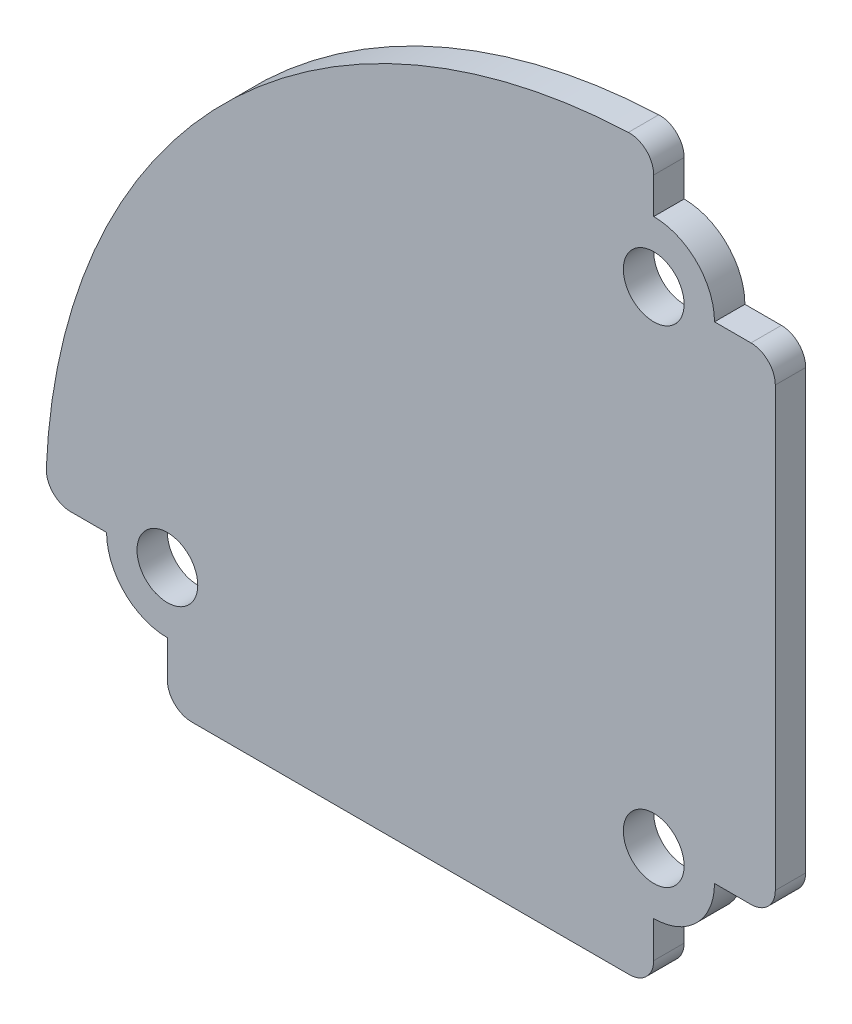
SolidWorks part; units mm, degrees
ref_plane "Front Plane" through (0, 0, 0) normal (0, 0, 1) x (1, 0, 0)
ref_plane "Top Plane" through (0, 0, 0) normal (0, 1, 0) x (1, 0, 0)
ref_plane "Right Plane" through (0, 0, 0) normal (1, 0, 0) x (0, 0, -1)
sketch "Sketch1" plane through (0, 0, 0) normal (0, 0, 1) x (1, 0, 0)
  line L0 (10.16, 50.8) -> (6.35, 50.8)
  line L2 (-60.9071, 0) -> (-57.15, 0)
  line L3 (-50.8, -6.35) -> (-50.8, -10.16)
  line L5 (-48.26, -12.7) -> (-2.54, -12.7)
  line L7 (0, -10.16) -> (0, -6.35)
  line L8 (6.35, 0) -> (10.16, 0)
  line L9 (12.7, 2.54) -> (12.7, 48.26)
  line L10 (0, 57.15) -> (0, 60.9071)
  arc A0 (-50.8, -10.16) -> (-48.26, -12.7) centre (-48.26, -10.16) ccw
  arc A1 (-60.9071, 0) -> (-63.4449, 2.6458) centre (-60.9071, 2.54) cw
  circle A2 centre (0, 50.8) radius 3.175
  circle A3 centre (0, 0) radius 3.175
  arc A4 (6.35, 50.8) -> (0, 57.15) centre (0, 50.8) ccw
  arc A5 (0, -6.35) -> (6.35, 0) centre (0, 0) ccw
  arc A6 (-2.54, -12.7) -> (0, -10.16) centre (-2.54, -10.16) ccw
  circle A7 centre (-50.8, 0) radius 3.175
  arc A8 (-57.15, 0) -> (-50.8, -6.35) centre (-50.8, 0) ccw
  arc A9 (10.16, 0) -> (12.7, 2.54) centre (10.16, 2.54) ccw
  arc A10 (12.7, 48.26) -> (10.16, 50.8) centre (10.16, 48.26) ccw
  arc A11 (0, 60.9071) -> (-2.6458, 63.4449) centre (-2.54, 60.9071) ccw
  arc A12 (-2.6458, 63.4449) -> (-63.4449, 2.6458) centre (0, 0) ccw
  point P8 (-50.8, -12.7)
  point P20 (-63.5, 0)
  point P22 (0, -12.7)
  point P30 (12.7, 0)
  point P33 (12.7, 50.8)
  point P36 (0, 63.5)
  dimension "D1" = 2.54
  dimension "D2" = 2.54
extrude "Boss-Extrude1" add sketch "Sketch1" along normal blind 3.175
